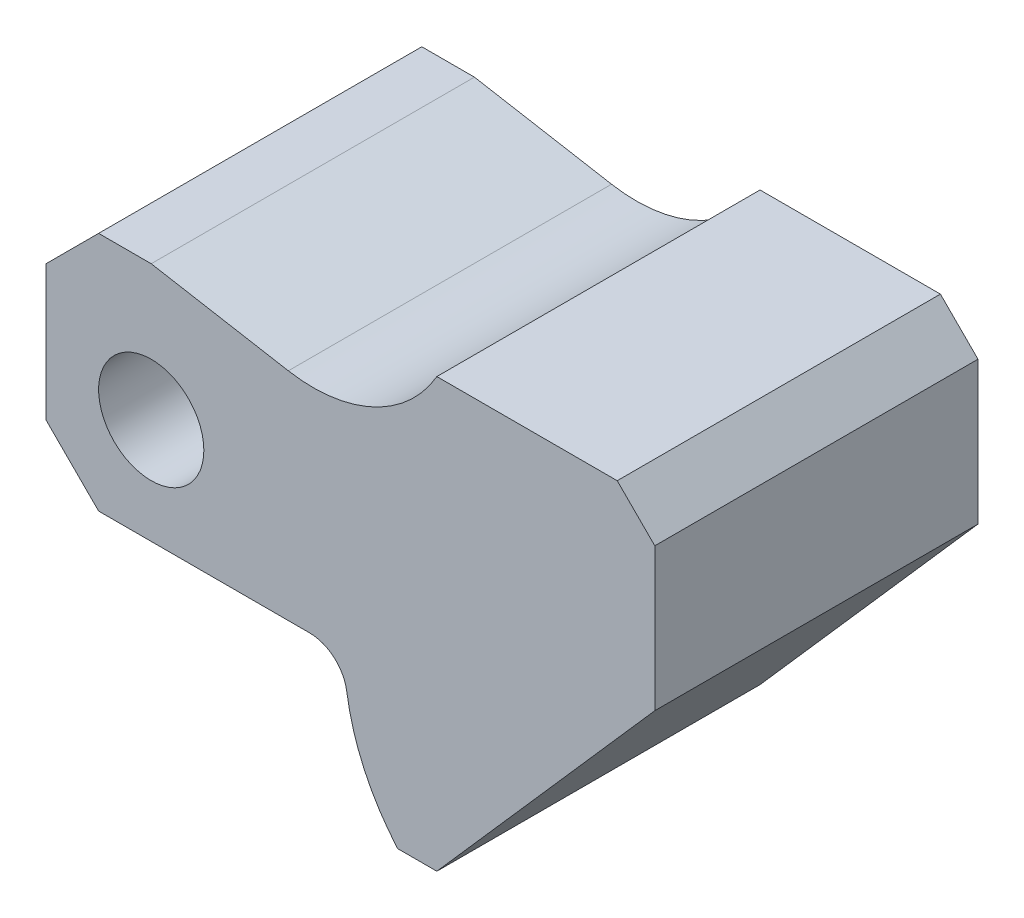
SolidWorks part; units mm, degrees
ref_plane "Front Plane" through (0, 0, 0) normal (0, 0, 1) x (1, 0, 0)
ref_plane "Top Plane" through (0, 0, 0) normal (0, 1, 0) x (1, 0, 0)
ref_plane "Right Plane" through (0, 0, 0) normal (1, 0, 0) x (0, 0, -1)
sketch "Sketch1" plane through (0, 0, 0) normal (0, 0, 1) x (1, 0, 0)
  line L0 (7, 19) -> (35.0666, 19)
  line L1 (0, 0) -> (81, 0)
  line L2 (0, 0) -> (0, 57)
  line L3 (0, 57) -> (81, 57)
  line L4 (81, 0) -> (81, 57)
  line L5 (0, 0) -> (81, 57) construction
  line L6 (0, 57) -> (81, 0) construction
  line L8 (81, 52) -> (76, 57)
  line L12 (0, 26) -> (7, 19)
  line L13 (0, 19) -> (7, 19)
  line L16 (81, 33) -> (52, 0)
  line L22 (0, 51) -> (14, 51)
  line L23 (0, 44) -> (7, 51)
  line L24 (14, 51) -> (52, 51) construction
  line L25 (35.5424, 66.4946) -> (35.5424, 47.4946) construction
  line L26 (14, 51) -> (32.2431, 47.7832)
  circle A0 centre (14, 33) radius 7
  arc A1 (32.2431, 47.7832) -> (52, 57) centre (35.5424, 66.4946) ccw
  arc A2 (46.7881, 0) -> (40.0123, 14.7353) centre (68.697, 19) cw
  arc A3 (40.0123, 14.7353) -> (35.0666, 19) centre (35.0666, 14) ccw
  point P4 (40.5, 28.5)
  point P16 (68.697, 19)
extrude "Boss-Extrude3" add sketch "Sketch1" along normal blind 43 contours A3 A2 L1 L16 L4 L8 L3 A1 L26 L22 L23 L2 L12 L0 A0
equation "\"A\"=81"
equation "\"D1@Sketch1\"=\"A\""
equation "\"B\"=57"
equation "\"D2@Sketch1\"=\"B\""
equation "\"C\"=43"
equation "\"D1@Boss-Extrude3\"=\"C\""
